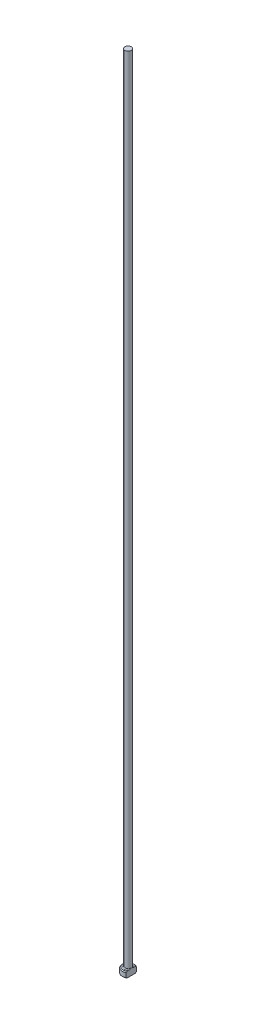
SolidWorks part; units mm, degrees
ref_plane "Front Plane" through (0, 0, 0) normal (0, 0, 1) x (1, 0, 0)
ref_plane "Top Plane" through (0, 0, 0) normal (0, 1, 0) x (1, 0, 0)
ref_plane "Right Plane" through (0, 0, 0) normal (1, 0, 0) x (0, 0, -1)
sketch "Sketch1" plane through (0, 0, 0) normal (0, 0, 1) x (1, 0, 0)
  line L0 (0, 259.9588) -> (0, -15.1925) construction
  line L1 (0, 0) -> (-1.5, 0)
  line L2 (-1.5, 0) -> (-1.5, 1.5)
  line L3 (-1.5, 1.5) -> (-0.8, 1.5)
  line L4 (-0.8, 1.5) -> (-0.8, 200)
  line L5 (-0.8, 200) -> (0, 200)
  line L6 (0, 200) -> (0, 0)
  dimension "L" = 200
  dimension "H" = 3
  dimension "T" = 1.5
  dimension "D" = 1.6
revolve "Revolve1" add sketch "Sketch1" angle 360 about L0
chamfer "Chamfer1" distance 0.2 angle 45 2 edges at (0, 1.5, 1.5) (0, 0, 1.5)
fillet "Fillet1" radius 0.2 1 edges at (0, 1.5, 0.8)
sketch "Sketch2" plane through (0, 0, 0) normal (0, 1, 0) x (1, 0, 0)
  line L0 (0.8, 1.2689) -> (0.8, -1.2689)
  circle A0 centre (0, 0) radius 1.5 construction
  arc A1 (0.8, -1.2689) -> (0.8, 1.2689) centre (0, 0) ccw
  circle A2 centre (0, 0) radius 0.8 construction
extrude "KEY" cut sketch "Sketch2" along normal through all
